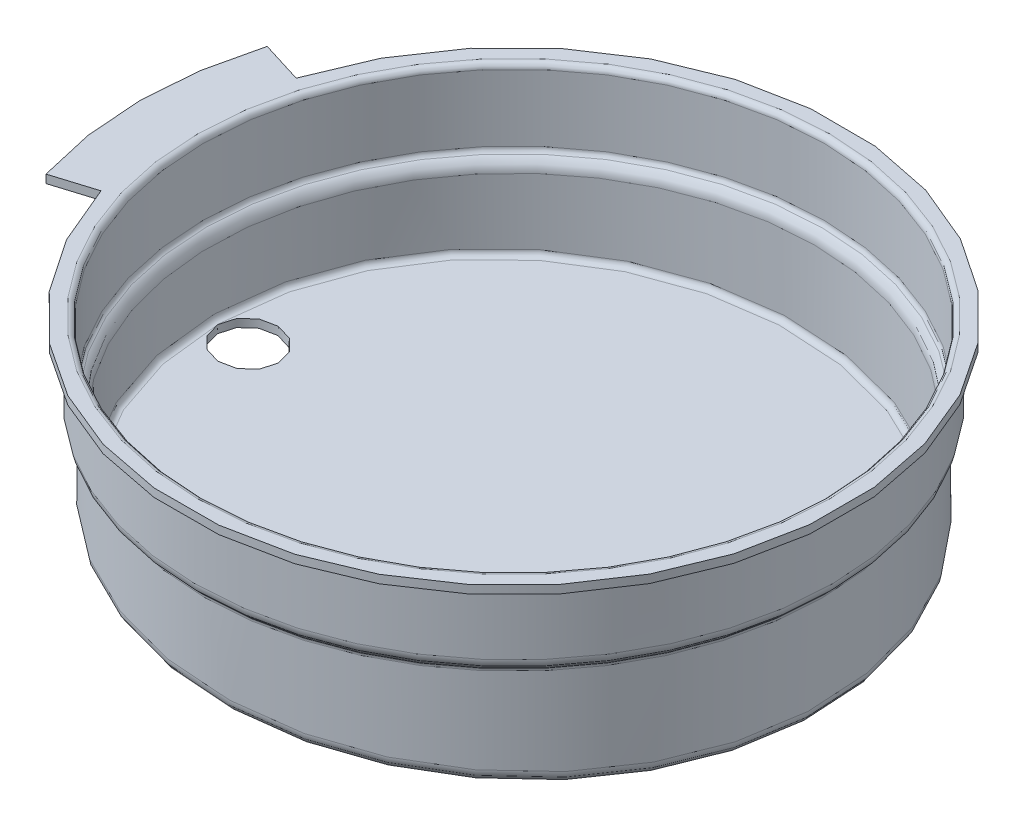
SolidWorks part; units mm, degrees
ref_plane "Front" through (0, 0, 0) normal (0, 0, 1) x (1, 0, 0)
ref_plane "Top" through (0, 0, 0) normal (0, 1, 0) x (1, 0, 0)
ref_plane "Right" through (0, 0, 0) normal (1, 0, 0) x (0, 0, -1)
sketch "Sketch1" plane through (0, 0, 0) normal (0, 1, 0) x (1, 0, 0)
  circle A0 centre (0, 0) radius 29.464
  dimension "D1" = 58.928
extrude "Base-Extrude" add sketch "Sketch1" against normal blind 7.874
sketch "Sketch2" plane through (0, -7.874, 0) normal (0, -1, 0) x (1, 0, 0)
  circle A0 centre (0, 0) radius 28.575
  dimension "D1" = 57.15
sketch "Sketch3" plane through (0, 0, 0) normal (1, 0, 0) x (0, 0, -1)
  line L0 (-17.549, -16.51) -> (13.0256, -16.51) construction
  dimension "D1" = 16.51
ref_plane "Plane4" through (-0.8629, -16.4648, 0) normal (0.0523, 0.9986, 0) x (-0.9986, 0.0523, 0)
extrude "Boss-Extrude1" add sketch "Sketch2" along normal up to surface (8.636 mm away)
fillet "Fillet1" radius 1.27 2 edges at (0, -7.874, 29.464) (-28.575, -15.0124, 0)
fillet "Fillet2" radius 0.508 1 edges at (0, -7.874, 28.575)
shell "Shell1" thickness 0.762
sketch "Sketch4" plane through (0, 0, 0) normal (0, 1, 0) x (-1, 0, 0)
  circle A0 centre (0, 0) radius 28.702 construction
  circle A1 centre (0, 0) radius 30.48
  circle A2 centre (0, 0) radius 30.48
  circle A3 centre (0, 0) radius 28.702
  dimension "D1" = 1.778
extrude "Boss-Extrude2" add sketch "Sketch4" against normal blind 0.762
fillet "Fillet3" radius 0.508 2 edges at (0, 0, 28.702) (0, -0.762, 29.464)
sketch "Sketch5" plane through (0, 0, 0) normal (0, 1, 0) x (-1, 0, 0)
  line L0 (0, 0) -> (10.3388, 0) construction
  line L1 (29.1157, -9.017) -> (32.9978, -10.2193)
  line L2 (29.1157, 9.017) -> (32.9978, 10.2193)
  circle A0 centre (0, 0) radius 30.48 construction
  circle A1 centre (0, 0) radius 34.544
  arc A2 (32.9978, -10.2193) -> (32.9978, 10.2193) centre (0, 0) ccw
  arc A3 (29.1157, -9.017) -> (29.1157, 9.017) centre (0, 0) ccw
  dimension "D2" = 18.034
  dimension "D1" = 4.064
extrude "Boss-Extrude3" add sketch "Sketch5" against normal up to surface (0.762 mm away)
sketch "Sketch6" plane through (-0.823, -15.7038, 0) normal (0.0523, 0.9986, 0) x (-0.9986, 0.0523, 0)
  line L0 (-0.7975, 0) -> (-27.2948, -7.0999) construction
  line L1 (-0.7975, 0) -> (-27.2948, 7.0999) construction
  line L2 (-0.7975, 0) -> (-17.8234, 0) construction
  circle A0 centre (23.751, 0) radius 2.794
  arc A1 (-27.2948, 7.0999) -> (-27.2948, -7.0999) centre (-0.7975, 0) ccw
  arc A2 (-20.392, 5.3931) -> (-20.392, -5.3931) centre (3.3881, 0) ccw
  arc A3 (-27.2948, -7.0999) -> (-20.392, -5.3931) centre (-23.86, -6.1796) ccw
  arc A4 (-27.2948, 7.0999) -> (-20.392, 5.3931) centre (-23.86, 6.1796) cw
  ellipse E0 centre (-0.7975, 0) end of major axis (26.545, 0) minor radius 27.305 construction
  dimension "D1" = 5.588
  dimension "D2" = 7.112
  dimension "D3" = 27.432
  dimension "D4" = 24.384
  dimension "D5" = 30
  dimension "D6" = 15
extrude "Cut-Extrude1" cut sketch "Sketch6" against normal through all
